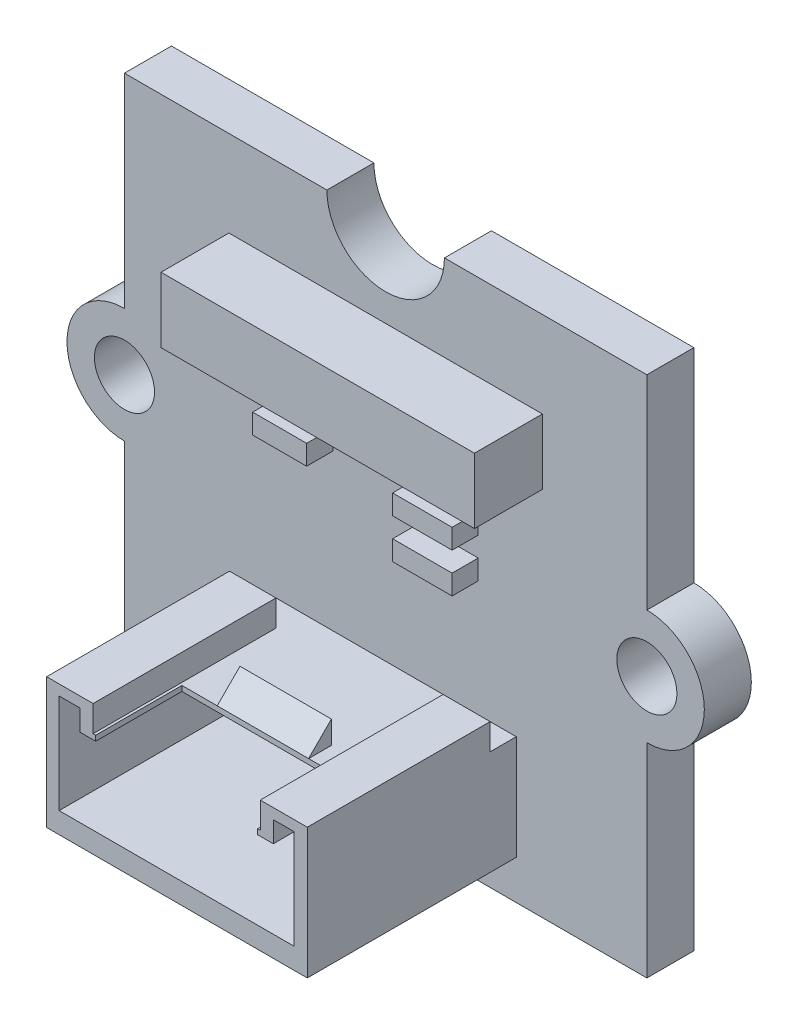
SolidWorks part; units mm, degrees
ref_plane "Plan de face" through (0, 0, 0) normal (0, 0, 1) x (1, 0, 0)
ref_plane "Plan de dessus" through (0, 0, 0) normal (0, 1, 0) x (1, 0, 0)
ref_plane "Plan de droite" through (0, 0, 0) normal (1, 0, 0) x (0, 0, -1)
sketch "Esquisse1" plane through (0, 0, 0) normal (0, 0, 1) x (1, 0, 0)
  line L0 (-2.7446, 10.9929) -> (-2.7446, -9.0071) construction
  line L1 (-12.7446, 10.9929) -> (-4.9946, 10.9929)
  line L2 (-12.7446, 10.9929) -> (-12.7446, 3.1929)
  line L3 (-12.7446, -9.0071) -> (-4.9946, -9.0071)
  line L4 (7.2554, 10.9929) -> (7.2554, 3.1929)
  line L5 (-12.7446, 0.9929) -> (7.2554, 0.9929) construction
  line L6 (-0.4946, 10.9929) -> (7.2554, 10.9929)
  line L7 (-0.4946, -9.0071) -> (7.2554, -9.0071)
  line L8 (-12.7446, -1.2071) -> (-12.7446, -9.0071)
  line L9 (7.2554, -1.2071) -> (7.2554, -9.0071)
  arc A0 (-4.9946, 10.9929) -> (-0.4946, 10.9929) centre (-2.7446, 10.9929) ccw
  arc A1 (-0.4946, -9.0071) -> (-4.9946, -9.0071) centre (-2.7446, -9.0071) ccw
  arc A2 (-12.7446, 3.1929) -> (-12.7446, -1.2071) centre (-12.7446, 0.9929) ccw
  arc A3 (7.2554, -1.2071) -> (7.2554, 3.1929) centre (7.2554, 0.9929) ccw
  circle A4 centre (-12.7446, 0.9929) radius 1.15
  circle A5 centre (7.2554, 0.9929) radius 1.15
  dimension "D1" = 20
  dimension "D2" = 20
extrude "Boss.-Extru.1" add sketch "Esquisse1" along normal blind 1.8
sketch "Esquisse2" plane through (0, 0, 1.8) normal (0, 0, 1) x (1, 0, 0)
  line L0 (-12.7446, -1.2071) -> (-12.7446, -9.0071) construction
  line L1 (-8.7446, -7.5071) -> (3.2554, -7.5071)
  line L2 (-8.7446, -7.5071) -> (-8.7446, -6.7071)
  line L3 (-8.7446, -2.5071) -> (3.2554, -2.5071)
  line L4 (3.2554, -7.5071) -> (3.2554, -6.7071)
  line L5 (-12.7446, -9.0071) -> (-4.9946, -9.0071) construction
  line L6 (3.2554, -4.4071) -> (2.2554, -4.4071)
  line L7 (-8.7446, -4.4071) -> (-7.7446, -4.4071)
  line L9 (-8.7446, -6.7071) -> (-7.7446, -6.7071)
  line L10 (-7.7446, -4.4071) -> (-7.7446, -6.7071)
  line L11 (2.2554, -4.4071) -> (2.2554, -6.7071)
  line L12 (2.2554, -6.7071) -> (3.2554, -6.7071)
  line L13 (-8.7446, -4.4071) -> (-8.7446, -2.5071)
  line L14 (3.2554, -4.4071) -> (3.2554, -2.5071)
  dimension "D1" = 12
  dimension "D2" = 5
  dimension "D3" = 4
  dimension "D4" = 1.5
  dimension "D5" = 1.9
  dimension "D6" = 1
  dimension "D7" = 2.3
extrude "Boss.-Extru.2" add sketch "Esquisse2" along normal blind 8
sketch "Esquisse3" plane through (0, 0, 9.8) normal (0, 0, 1) x (1, 0, 0)
  line L0 (-8.7446, -7.5071) -> (3.2554, -7.5071) construction
  line L1 (-6.4446, -3.7071) -> (0.9554, -3.7071)
  line L2 (-7.2446, -3.7071) -> (-7.2446, -6.7071)
  line L3 (-7.2446, -6.7071) -> (1.7554, -6.7071)
  line L4 (1.7554, -3.7071) -> (1.7554, -6.7071)
  line L5 (-7.7446, -4.4071) -> (-7.7446, -6.7071) construction
  line L6 (-7.2446, -3.7071) -> (-7.2446, -2.9071)
  line L7 (-7.2446, -2.9071) -> (-6.4446, -2.9071)
  line L8 (-6.4446, -2.9071) -> (-6.4446, -3.7071)
  line L9 (1.7554, -3.7071) -> (1.7554, -2.9071)
  line L10 (1.7554, -2.9071) -> (0.9554, -2.9071)
  line L11 (0.9554, -2.9071) -> (0.9554, -3.7071)
  dimension "D1" = 3
  dimension "D2" = 0.8
  dimension "D3" = 9
  dimension "D4" = 0.5
extrude "Enlèv. mat.-Extru.1" cut sketch "Esquisse3" against normal blind 7
sketch "Esquisse4" plane through (0, -2.5071, 0) normal (0, 1, 0) x (1, 0, 0)
  line L0 (-8.7446, -1.8) -> (3.2554, -1.8)
  line L1 (3.2554, -1.8) -> (3.2554, -2.8)
  line L2 (3.2554, -9.8) -> (3.2554, -1.8) construction
  line L3 (3.2554, -2.8) -> (0.4554, -2.8)
  line L4 (-8.7446, -1.8) -> (-8.7446, -2.8)
  line L5 (-8.7446, -9.8) -> (-8.7446, -1.8) construction
  line L6 (-8.7446, -2.8) -> (-5.9446, -2.8)
  line L7 (-5.9446, -2.8) -> (-5.9446, -9.8)
  line L8 (3.2554, -9.8) -> (-8.7446, -9.8) construction
  line L9 (0.4554, -2.8) -> (0.4554, -9.8)
  line L10 (0.4554, -9.8) -> (-5.9446, -9.8)
  line L11 (-2.7446, -9.8) -> (-2.7446, -3.7286) construction
  line L13 (-4.4946, -5.6264) -> (-0.9946, -5.6264)
  line L14 (-4.4946, -5.6264) -> (-4.4946, -6.5)
  line L15 (-4.4946, -6.5) -> (-0.9946, -6.5)
  line L16 (-0.9946, -5.6264) -> (-0.9946, -6.5)
  point P22 (-4.4946, -6.0632)
  dimension "D1" = 3.3
  dimension "D2" = 3.5
  dimension "D3" = 1.75
  dimension "D4" = 2.8
  dimension "D5" = 2.8
extrude "Enlèv. mat.-Extru.2" cut sketch "Esquisse4" against normal blind 1
sketch "Esquisse5" plane through (0, -2.5071, 0) normal (0, 1, 0) x (1, 0, 0)
  line L0 (-8.7446, -9.8) -> (-8.7446, -2.8) construction
  line L1 (-8.7446, -9.8) -> (-7.7446, -9.8)
  line L2 (-8.7446, -9.8) -> (-8.7446, -8.8)
  line L3 (-8.7446, -8.8) -> (-7.7446, -8.8)
  line L4 (-7.7446, -9.8) -> (-7.7446, -8.8)
  line L5 (-5.9446, -9.8) -> (-8.7446, -9.8) construction
  line L7 (3.2554, -9.8) -> (2.2554, -9.8)
  line L8 (3.2554, -9.8) -> (3.2554, -8.8)
  line L9 (3.2554, -8.8) -> (2.2554, -8.8)
  line L10 (2.2554, -9.8) -> (2.2554, -8.8)
  dimension "D1" = 1
  dimension "D2" = 1
  dimension "D3" = 1
extrude "Enlèv. mat.-Extru.3" cut sketch "Esquisse5" against normal blind 11
sketch "Esquisse6" plane through (0, -3.5071, 0) normal (0, 1, 0) x (1, 0, 0)
  line L0 (-5.9446, -9.8) -> (0.4554, -9.8) construction
  line L1 (-5.8446, -9.8) -> (0.3554, -9.8)
  line L2 (-5.8446, -9.8) -> (-5.8446, -6.5)
  line L3 (-5.8446, -6.5) -> (0.3554, -6.5)
  line L4 (0.3554, -9.8) -> (0.3554, -6.5)
  line L5 (-8.7446, -8.8) -> (-8.7446, -2.8) construction
  dimension "D1" = 6.2
  dimension "D2" = 2.9
  dimension "D3" = 3.3
extrude "Enlèv. mat.-Extru.4" cut sketch "Esquisse6" against normal blind 1
chamfer "Chanfrein1" distance 1 angle 45 1 edges at (-2.7446, -2.5071, 6.5)
sketch "Esquisse7" plane through (0, 0, 9.8) normal (0, 0, 1) x (1, 0, 0)
  line L1 (-7.7229, -2.4877) -> (-10.6339, -2.4877)
  line L2 (-7.7229, -2.4877) -> (-7.7229, -8.7316)
  line L3 (-7.7229, -8.7316) -> (-10.6339, -8.7316)
  line L4 (-10.6339, -2.4877) -> (-10.6339, -8.7316)
  line L5 (2.2554, -2.5071) -> (5.2712, -2.5071)
  line L6 (2.2554, -2.5071) -> (2.2554, -8.0566)
  line L7 (2.2554, -8.0566) -> (5.2712, -8.0566)
  line L8 (5.2712, -2.5071) -> (5.2712, -8.0566)
extrude "Enlèv. mat.-Extru.5" cut sketch "Esquisse7" against normal blind 8
sketch "Esquisse8" plane through (0, 0, 1.8) normal (0, 0, 1) x (1, 0, 0)
  line L0 (-12.7446, 10.9929) -> (-12.7446, 3.1929) construction
  line L1 (-8.7446, 7.6929) -> (3.2554, 7.6929)
  line L2 (-8.7446, 7.6929) -> (-8.7446, 5.1929)
  line L3 (-8.7446, 5.1929) -> (3.2554, 5.1929)
  line L4 (3.2554, 7.6929) -> (3.2554, 5.1929)
  line L5 (-4.9946, 10.9929) -> (-12.7446, 10.9929) construction
  dimension "D1" = 2.5
  dimension "D2" = 12
  dimension "D3" = 4
  dimension "D4" = 3.3
extrude "Boss.-Extru.3" add sketch "Esquisse8" along normal blind 2.6
sketch "Esquisse9" plane through (0, 0, 1.8) normal (0, 0, 1) x (1, 0, 0)
  line L1 (-6.8369, 3.2078) -> (-4.7697, 3.2078)
  line L2 (-6.8369, 3.2078) -> (-6.8369, 2.4484)
  line L3 (-6.8369, 2.4484) -> (-4.7697, 2.4484)
  line L4 (-4.7697, 3.2078) -> (-4.7697, 2.4484)
  line L5 (-1.479, 3.2078) -> (0.7992, 3.2078)
  line L6 (-1.479, 3.2078) -> (-1.479, 2.4484)
  line L7 (-1.479, 2.4484) -> (0.7992, 2.4484)
  line L8 (0.7992, 3.2078) -> (0.7992, 2.4484)
  line L9 (-1.479, 1.689) -> (0.7992, 1.689)
  line L10 (-1.479, 1.689) -> (-1.479, 0.9296)
  line L11 (-1.479, 0.9296) -> (0.7992, 0.9296)
  line L12 (0.7992, 1.689) -> (0.7992, 0.9296)
extrude "Boss.-Extru.4" add sketch "Esquisse9" along normal blind 1
